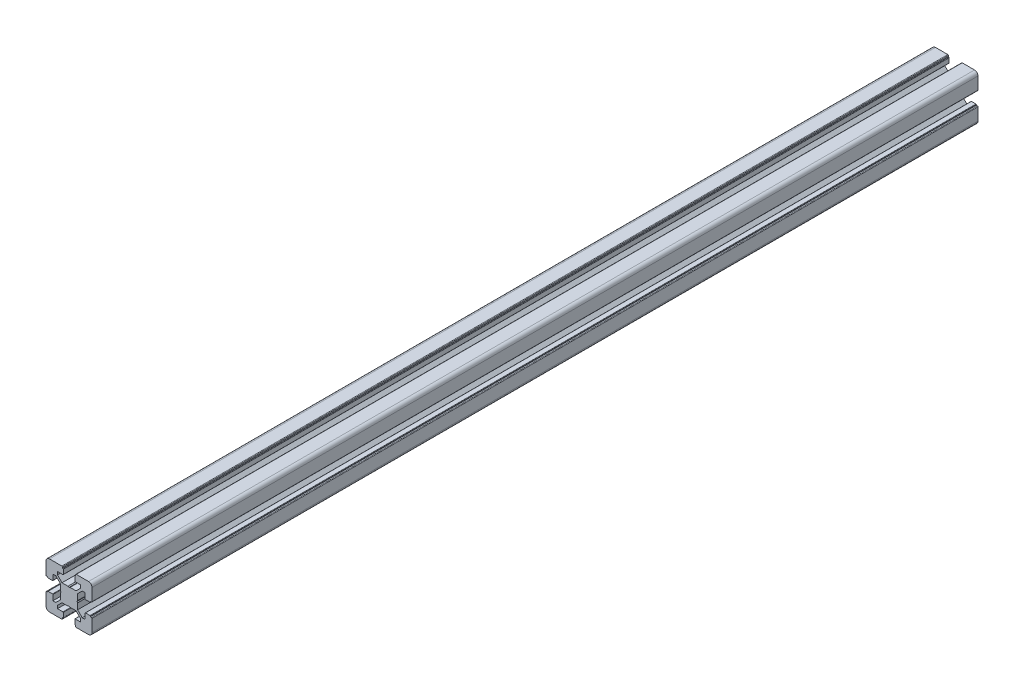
SolidWorks part; units mm, degrees
ref_plane "Front Plane" through (0, 0, 0) normal (0, 0, 1) x (1, 0, 0)
ref_plane "Top Plane" through (0, 0, 0) normal (0, 1, 0) x (1, 0, 0)
ref_plane "Right Plane" through (0, 0, 0) normal (1, 0, 0) x (0, 0, -1)
sketch "Sketch2" plane through (0, 0, 0) normal (0, 0, 1) x (1, 0, 0)
  line L72 (-20.3, 9.9499) -> (-20.3, 14.7)
  line L73 (-20.6, 15) -> (-24.5, 15)
  line L74 (-24.8, 14.7) -> (-24.8, 14.2)
  line L75 (-24.8, 14.2) -> (-25.8, 14.2)
  line L76 (-26.3, 13.7) -> (-26.3, 3)
  line L77 (-23.3, 0) -> (-12.6, 0)
  line L78 (-12.1, 0.5) -> (-12.1, 1.5)
  line L79 (-12.1, 1.5) -> (-11.6, 1.5)
  line L80 (-11.3, 1.8) -> (-11.3, 5.7)
  line L81 (-11.6, 6) -> (-16.3501, 6)
  line L82 (-16.3501, 6) -> (-16.3501, 8.5356)
  line L83 (-16.3501, 8.5356) -> (-12.3856, 12.5001)
  line L84 (-12.3856, 12.5001) -> (-7.166, 12.5001)
  line L85 (-7.166, 12.5001) -> (-6.3, 13.0001)
  line L86 (-6.3, 13.0001) -> (-5.4339, 12.5001)
  line L87 (-5.4339, 12.5001) -> (-0.2143, 12.5001)
  line L88 (-0.2143, 12.5001) -> (3.7501, 8.5357)
  line L89 (3.7501, 8.5357) -> (3.7501, 6)
  line L90 (3.7501, 6) -> (-1, 6)
  line L91 (-1.3, 5.7) -> (-1.3, 1.8)
  line L92 (-1, 1.5) -> (-0.5, 1.5)
  line L93 (-0.5, 1.5) -> (-0.5, 0.5)
  line L94 (0, 0) -> (10.7, 0)
  line L95 (13.7, 3) -> (13.7, 13.7)
  line L96 (13.2, 14.2) -> (12.2, 14.2)
  line L97 (12.2, 14.2) -> (12.2, 14.7)
  line L98 (11.9, 15) -> (8, 15)
  line L99 (7.7, 14.7) -> (7.7, 9.9498)
  line L100 (7.7, 9.9498) -> (5.1644, 9.9498)
  line L101 (5.1644, 9.9498) -> (1.1999, 13.9143)
  line L102 (1.1999, 13.9143) -> (1.1999, 19.134)
  line L103 (1.1999, 19.134) -> (0.6999, 20)
  line L104 (0.6999, 20) -> (1.1999, 20.866)
  line L105 (1.1999, 20.866) -> (1.1999, 26.0857)
  line L106 (1.1999, 26.0857) -> (5.1643, 30.0501)
  line L107 (5.1643, 30.0501) -> (7.7, 30.0501)
  line L108 (7.7, 30.0501) -> (7.7, 25.3)
  line L109 (8, 25) -> (11.9, 25)
  line L110 (12.2, 25.3) -> (12.2, 25.8)
  line L111 (12.2, 25.8) -> (13.2, 25.8)
  line L112 (13.7, 26.3) -> (13.7, 37)
  line L113 (10.7, 40) -> (0.0001, 40)
  line L114 (-0.4999, 39.5) -> (-0.4999, 38.5)
  line L115 (-0.4999, 38.5) -> (-0.9999, 38.5)
  line L116 (-1.2999, 38.2) -> (-1.2999, 34.3)
  line L117 (-0.9999, 34) -> (3.7502, 34)
  line L118 (3.7502, 34) -> (3.7502, 31.4644)
  line L119 (3.7502, 31.4644) -> (-0.2143, 27.4999)
  line L120 (-0.2143, 27.4999) -> (-5.4339, 27.4999)
  line L121 (-5.4339, 27.4999) -> (-6.3, 26.9999)
  line L122 (-6.3, 26.9999) -> (-7.166, 27.4999)
  line L123 (-7.166, 27.4999) -> (-12.3856, 27.4999)
  line L124 (-12.3856, 27.4999) -> (-16.3501, 31.4643)
  line L125 (-16.3501, 31.4643) -> (-16.3501, 34)
  line L126 (-16.3501, 34) -> (-11.5999, 34)
  line L127 (-11.2999, 34.3) -> (-11.2999, 38.2)
  line L128 (-11.5999, 38.5) -> (-12.0999, 38.5)
  line L129 (-12.0999, 38.5) -> (-12.0999, 39.5)
  line L130 (-12.5999, 40) -> (-23.3, 40)
  line L131 (-26.3, 37) -> (-26.3, 26.3)
  line L132 (-25.8, 25.8) -> (-24.8, 25.8)
  line L133 (-24.8, 25.8) -> (-24.8, 25.3)
  line L134 (-24.5, 25) -> (-20.6, 25)
  line L135 (-20.3, 25.3) -> (-20.3, 30.0502)
  line L136 (-20.3, 30.0502) -> (-17.7643, 30.0502)
  line L137 (-17.7643, 30.0502) -> (-13.7999, 26.0857)
  line L138 (-13.7999, 26.0857) -> (-13.7999, 20.866)
  line L139 (-13.7999, 20.866) -> (-13.2999, 20)
  line L140 (-13.2999, 20) -> (-13.7999, 19.134)
  line L141 (-13.7999, 19.134) -> (-13.7999, 13.9143)
  line L142 (-13.7999, 13.9143) -> (-17.7643, 9.9499)
  line L143 (-17.7643, 9.9499) -> (-20.3, 9.9499)
  line L144 (-20.3, 9.9499) -> (-20.3, 14.7)
  line L145 (-20.6, 15) -> (-24.5, 15)
  line L146 (-24.8, 14.7) -> (-24.8, 14.2)
  line L147 (-24.8, 14.2) -> (-25.8, 14.2)
  line L148 (-26.3, 13.7) -> (-26.3, 3)
  line L149 (-23.3, 0) -> (-12.6, 0)
  line L150 (-12.1, 0.5) -> (-12.1, 1.5)
  line L151 (-12.1, 1.5) -> (-11.6, 1.5)
  line L152 (-11.3, 1.8) -> (-11.3, 5.7)
  line L153 (-11.6, 6) -> (-16.3501, 6)
  line L154 (-16.3501, 6) -> (-16.3501, 8.5356)
  line L155 (-16.3501, 8.5356) -> (-12.3856, 12.5001)
  line L156 (-12.3856, 12.5001) -> (-7.166, 12.5001)
  line L157 (-7.166, 12.5001) -> (-6.3, 13.0001)
  line L158 (-6.3, 13.0001) -> (-5.4339, 12.5001)
  line L159 (-5.4339, 12.5001) -> (-0.2143, 12.5001)
  line L160 (-0.2143, 12.5001) -> (3.7501, 8.5357)
  line L161 (3.7501, 8.5357) -> (3.7501, 6)
  line L162 (3.7501, 6) -> (-1, 6)
  line L163 (-1.3, 5.7) -> (-1.3, 1.8)
  line L164 (-1, 1.5) -> (-0.5, 1.5)
  line L165 (-0.5, 1.5) -> (-0.5, 0.5)
  line L166 (0, 0) -> (10.7, 0)
  line L167 (13.7, 3) -> (13.7, 13.7)
  line L168 (13.2, 14.2) -> (12.2, 14.2)
  line L169 (12.2, 14.2) -> (12.2, 14.7)
  line L170 (11.9, 15) -> (8, 15)
  line L171 (7.7, 14.7) -> (7.7, 9.9498)
  line L172 (7.7, 9.9498) -> (5.1644, 9.9498)
  line L173 (5.1644, 9.9498) -> (1.1999, 13.9143)
  line L174 (1.1999, 13.9143) -> (1.1999, 19.134)
  line L175 (1.1999, 19.134) -> (0.6999, 20)
  line L176 (0.6999, 20) -> (1.1999, 20.866)
  line L177 (1.1999, 20.866) -> (1.1999, 26.0857)
  line L178 (1.1999, 26.0857) -> (5.1643, 30.0501)
  line L179 (5.1643, 30.0501) -> (7.7, 30.0501)
  line L180 (7.7, 30.0501) -> (7.7, 25.3)
  line L181 (8, 25) -> (11.9, 25)
  line L182 (12.2, 25.3) -> (12.2, 25.8)
  line L183 (12.2, 25.8) -> (13.2, 25.8)
  line L184 (13.7, 26.3) -> (13.7, 37)
  line L185 (10.7, 40) -> (0.0001, 40)
  line L186 (-0.4999, 39.5) -> (-0.4999, 38.5)
  line L187 (-0.4999, 38.5) -> (-0.9999, 38.5)
  line L188 (-1.2999, 38.2) -> (-1.2999, 34.3)
  line L189 (-0.9999, 34) -> (3.7502, 34)
  line L190 (3.7502, 34) -> (3.7502, 31.4644)
  line L191 (3.7502, 31.4644) -> (-0.2143, 27.4999)
  line L192 (-0.2143, 27.4999) -> (-5.4339, 27.4999)
  line L193 (-5.4339, 27.4999) -> (-6.3, 26.9999)
  line L194 (-6.3, 26.9999) -> (-7.166, 27.4999)
  line L195 (-7.166, 27.4999) -> (-12.3856, 27.4999)
  line L196 (-12.3856, 27.4999) -> (-16.3501, 31.4643)
  line L197 (-16.3501, 31.4643) -> (-16.3501, 34)
  line L198 (-16.3501, 34) -> (-11.5999, 34)
  line L199 (-11.2999, 34.3) -> (-11.2999, 38.2)
  line L200 (-11.5999, 38.5) -> (-12.0999, 38.5)
  line L201 (-12.0999, 38.5) -> (-12.0999, 39.5)
  line L202 (-12.5999, 40) -> (-23.3, 40)
  line L203 (-26.3, 37) -> (-26.3, 26.3)
  line L204 (-25.8, 25.8) -> (-24.8, 25.8)
  line L205 (-24.8, 25.8) -> (-24.8, 25.3)
  line L206 (-24.5, 25) -> (-20.6, 25)
  line L207 (-20.3, 25.3) -> (-20.3, 30.0502)
  line L208 (-20.3, 30.0502) -> (-17.7643, 30.0502)
  line L209 (-17.7643, 30.0502) -> (-13.7999, 26.0857)
  line L210 (-13.7999, 26.0857) -> (-13.7999, 20.866)
  line L211 (-13.7999, 20.866) -> (-13.2999, 20)
  line L212 (-13.2999, 20) -> (-13.7999, 19.134)
  line L213 (-13.7999, 19.134) -> (-13.7999, 13.9143)
  line L214 (-13.7999, 13.9143) -> (-17.7643, 9.9499)
  line L215 (-17.7643, 9.9499) -> (-20.3, 9.9499)
  arc A28 (-20.3, 14.7) -> (-20.6, 15) centre (-20.6, 14.7) ccw
  arc A29 (-24.5, 15) -> (-24.8, 14.7) centre (-24.5, 14.7) ccw
  arc A30 (-25.8, 14.2) -> (-26.3, 13.7) centre (-25.8, 13.7) ccw
  arc A31 (-26.3, 3) -> (-23.3, 0) centre (-23.3, 3) ccw
  arc A32 (-12.6, 0) -> (-12.1, 0.5) centre (-12.6, 0.5) ccw
  arc A33 (-11.6, 1.5) -> (-11.3, 1.8) centre (-11.6, 1.8) ccw
  arc A34 (-11.3, 5.7) -> (-11.6, 6) centre (-11.6, 5.7) ccw
  arc A35 (-1, 6) -> (-1.3, 5.7) centre (-1, 5.7) ccw
  arc A36 (-1.3, 1.8) -> (-1, 1.5) centre (-1, 1.8) ccw
  arc A37 (-0.5, 0.5) -> (0, 0) centre (0, 0.5) ccw
  arc A38 (10.7, 0) -> (13.7, 3) centre (10.7, 3) ccw
  arc A39 (13.7, 13.7) -> (13.2, 14.2) centre (13.2, 13.7) ccw
  arc A40 (12.2, 14.7) -> (11.9, 15) centre (11.9, 14.7) ccw
  arc A41 (8, 15) -> (7.7, 14.7) centre (8, 14.7) ccw
  arc A42 (7.7, 25.3) -> (8, 25) centre (8, 25.3) ccw
  arc A43 (11.9, 25) -> (12.2, 25.3) centre (11.9, 25.3) ccw
  arc A44 (13.2, 25.8) -> (13.7, 26.3) centre (13.2, 26.3) ccw
  arc A45 (13.7, 37) -> (10.7, 40) centre (10.7, 37) ccw
  arc A46 (0.0001, 40) -> (-0.4999, 39.5) centre (0.0001, 39.5) ccw
  arc A47 (-0.9999, 38.5) -> (-1.2999, 38.2) centre (-0.9999, 38.2) ccw
  arc A48 (-1.2999, 34.3) -> (-0.9999, 34) centre (-0.9999, 34.3) ccw
  arc A49 (-11.5999, 34) -> (-11.2999, 34.3) centre (-11.5999, 34.3) ccw
  arc A50 (-11.2999, 38.2) -> (-11.5999, 38.5) centre (-11.5999, 38.2) ccw
  arc A51 (-12.0999, 39.5) -> (-12.5999, 40) centre (-12.5999, 39.5) ccw
  arc A52 (-23.3, 40) -> (-26.3, 37) centre (-23.3, 37) ccw
  arc A53 (-26.3, 26.3) -> (-25.8, 25.8) centre (-25.8, 26.3) ccw
  arc A54 (-24.8, 25.3) -> (-24.5, 25) centre (-24.5, 25.3) ccw
  arc A55 (-20.6, 25) -> (-20.3, 25.3) centre (-20.6, 25.3) ccw
  arc A56 (-20.3, 14.7) -> (-20.6, 15) centre (-20.6, 14.7) ccw
  arc A57 (-24.5, 15) -> (-24.8, 14.7) centre (-24.5, 14.7) ccw
  arc A58 (-25.8, 14.2) -> (-26.3, 13.7) centre (-25.8, 13.7) ccw
  arc A59 (-26.3, 3) -> (-23.3, 0) centre (-23.3, 3) ccw
  arc A60 (-12.6, 0) -> (-12.1, 0.5) centre (-12.6, 0.5) ccw
  arc A61 (-11.6, 1.5) -> (-11.3, 1.8) centre (-11.6, 1.8) ccw
  arc A62 (-11.3, 5.7) -> (-11.6, 6) centre (-11.6, 5.7) ccw
  arc A63 (-1, 6) -> (-1.3, 5.7) centre (-1, 5.7) ccw
  arc A64 (-1.3, 1.8) -> (-1, 1.5) centre (-1, 1.8) ccw
  arc A65 (-0.5, 0.5) -> (0, 0) centre (0, 0.5) ccw
  arc A66 (10.7, 0) -> (13.7, 3) centre (10.7, 3) ccw
  arc A67 (13.7, 13.7) -> (13.2, 14.2) centre (13.2, 13.7) ccw
  arc A68 (12.2, 14.7) -> (11.9, 15) centre (11.9, 14.7) ccw
  arc A69 (8, 15) -> (7.7, 14.7) centre (8, 14.7) ccw
  arc A70 (7.7, 25.3) -> (8, 25) centre (8, 25.3) ccw
  arc A71 (11.9, 25) -> (12.2, 25.3) centre (11.9, 25.3) ccw
  arc A72 (13.2, 25.8) -> (13.7, 26.3) centre (13.2, 26.3) ccw
  arc A73 (13.7, 37) -> (10.7, 40) centre (10.7, 37) ccw
  arc A74 (0.0001, 40) -> (-0.4999, 39.5) centre (0.0001, 39.5) ccw
  arc A75 (-0.9999, 38.5) -> (-1.2999, 38.2) centre (-0.9999, 38.2) ccw
  arc A76 (-1.2999, 34.3) -> (-0.9999, 34) centre (-0.9999, 34.3) ccw
  arc A77 (-11.5999, 34) -> (-11.2999, 34.3) centre (-11.5999, 34.3) ccw
  arc A78 (-11.2999, 38.2) -> (-11.5999, 38.5) centre (-11.5999, 38.2) ccw
  arc A79 (-12.0999, 39.5) -> (-12.5999, 40) centre (-12.5999, 39.5) ccw
  arc A80 (-23.3, 40) -> (-26.3, 37) centre (-23.3, 37) ccw
  arc A81 (-26.3, 26.3) -> (-25.8, 25.8) centre (-25.8, 26.3) ccw
  arc A82 (-24.8, 25.3) -> (-24.5, 25) centre (-24.5, 25.3) ccw
  arc A83 (-20.6, 25) -> (-20.3, 25.3) centre (-20.6, 25.3) ccw
  dimension "D1" = 0
extrude "Boss-Extrude1" add sketch "Sketch2" along normal blind 770 contours L202 A80 L203 A81 L204 L205 A82 L206 A83 L207 L208 L209 L210 L211 L212 L213 L214 L215 L144 A56 L145 A57 L146 L147 A58 L148 A59 L149 A60 L150 L151 A61 L152 A62 L153 L154 L155 L156 L157 L158 L159 L160 L161 L162 A63 L163 A64 L164 L165 A65 L166 A66 L167 A67 L168 L169 A68 L170 A69 L171 L172 L173 L174 L175 L176 L177 L178 L179 L180 A70 L181 A71 L182 L183 A72 L184 A73 L185 A74 L186 L187 A75 L188 A76 L189 L190 L191 L192 L193 L194 L195 L196 L197 L198 A77 L199 A78 L200 L201 A79
